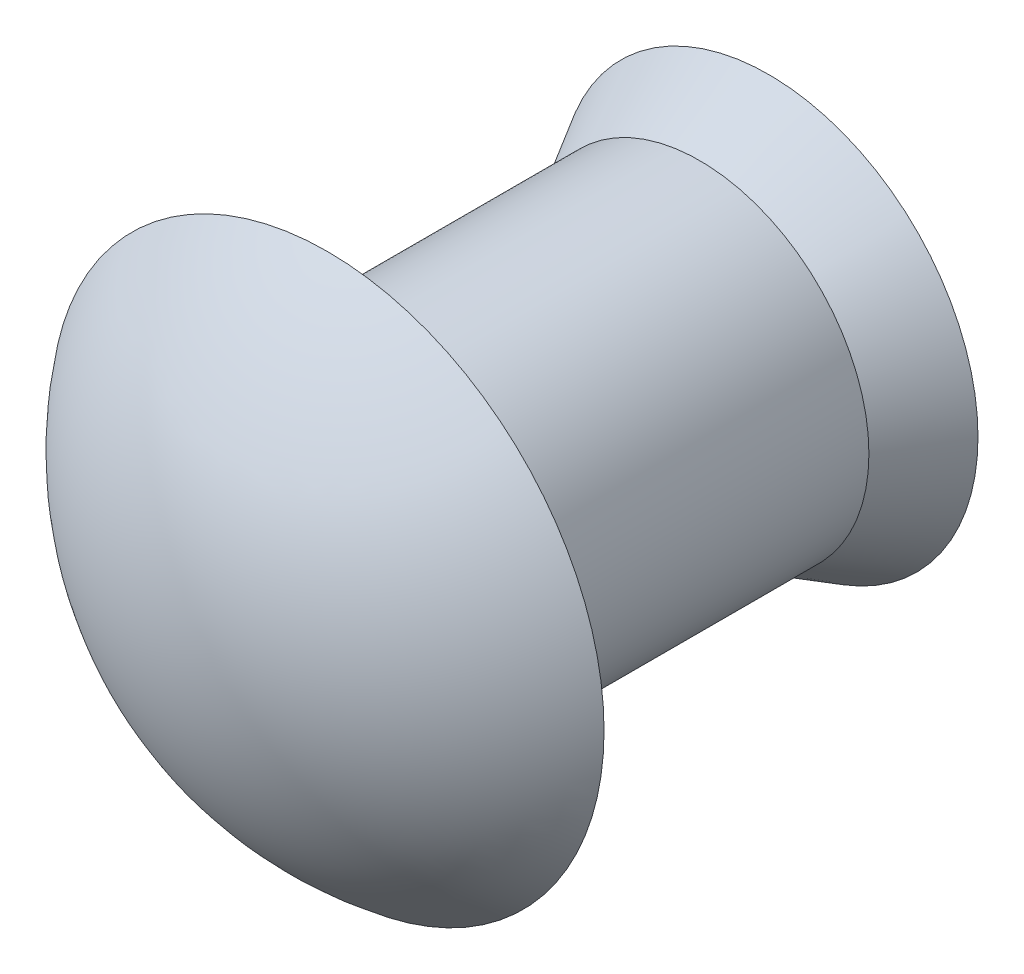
SolidWorks part; units mm, degrees
ref_plane "Спереди" through (0, 0, 0) normal (0, 0, 1) x (1, 0, 0)
ref_plane "Сверху" through (0, 0, 0) normal (0, 1, 0) x (1, 0, 0)
ref_plane "Справа" through (0, 0, 0) normal (1, 0, 0) x (0, 0, -1)
sketch "Эскиз1" plane through (0, 0, 0) normal (1, 0, 0) x (0, 0, -1)
  line L0 (0, 0) -> (45.7845, 0) construction
  line L1 (1.5875, 3.175) -> (1.5875, 1.9431)
  line L2 (1.5875, 1.9431) -> (5.8598, 1.9431)
  line L3 (5.8598, 1.9431) -> (6.6535, 2.4014)
  line L4 (6.6535, 2.4014) -> (6.6535, 0)
  line L5 (6.6535, 0) -> (0, 0)
  arc A0 (0, 0) -> (1.5875, 3.175) centre (3.9688, 0) cw
  dimension "D2" = 3.9688
  dimension "D1" = 6.35
  dimension "D3" = 30
  dimension "D4" = 0.7937
  dimension "D5" = 3.8862
  dimension "D6" = 4.2723
revolve "Повернуть1" add sketch "Эскиз1" angle 360 about L0
